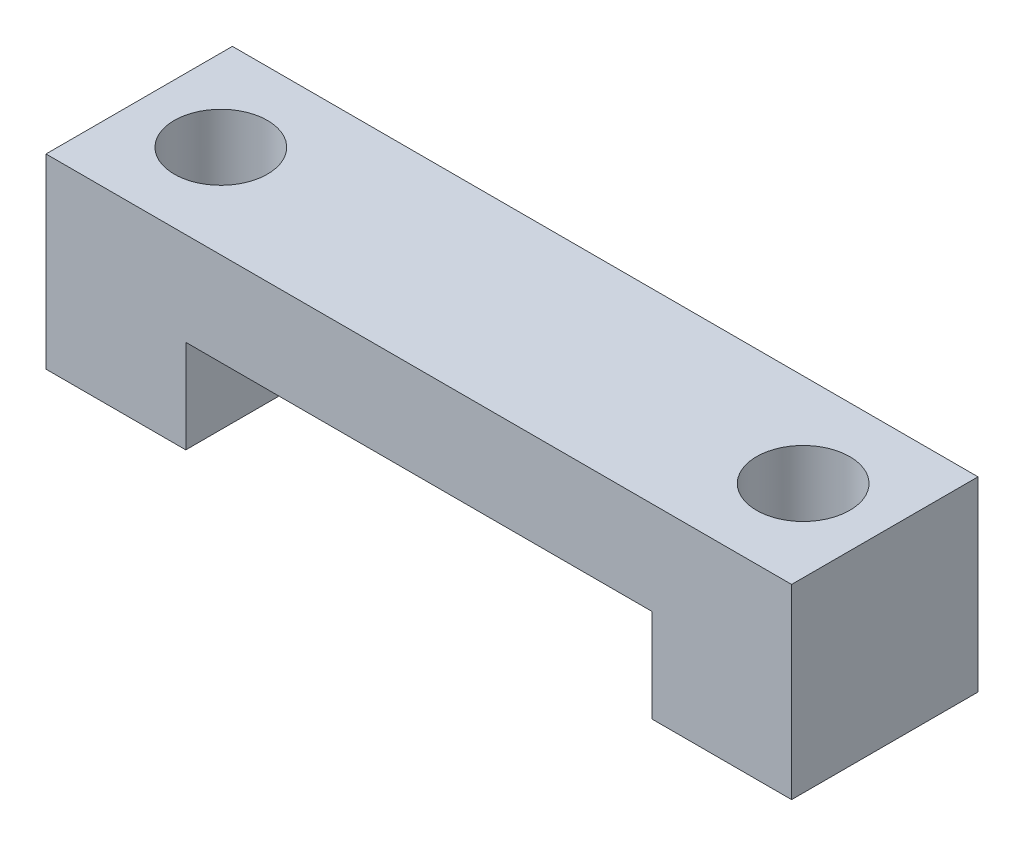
SolidWorks part; units mm, degrees
ref_plane "Front Plane" through (0, 0, 0) normal (0, 0, 1) x (1, 0, 0)
ref_plane "Top Plane" through (0, 0, 0) normal (0, 1, 0) x (1, 0, 0)
ref_plane "Right Plane" through (0, 0, 0) normal (1, 0, 0) x (0, 0, -1)
sketch "Sketch1" plane through (0, 0, 0) normal (0, 0, 1) x (1, 0, 0)
  line L0 (0, 0) -> (0, 9.6145) construction
  line L1 (15.875, 0) -> (15.875, 6.35)
  line L2 (15.875, 6.35) -> (-15.875, 6.35)
  line L3 (-15.875, 6.35) -> (-15.875, 0)
  line L4 (-15.875, 0) -> (-25.4, 0)
  line L5 (-25.4, 0) -> (-25.4, 12.7)
  line L6 (-25.4, 12.7) -> (25.4, 12.7)
  line L7 (25.4, 12.7) -> (25.4, 0)
  line L8 (25.4, 0) -> (15.875, 0)
  line L9 (-19.8374, 0) -> (-19.8374, 12.7)
  line L10 (19.8374, 0) -> (19.8374, 12.7)
  dimension "D1" = 31.75
  dimension "D2" = 50.8
  dimension "D3" = 6.35
  dimension "D4" = 6.35
  dimension "D5" = 5.5626
  dimension "D6" = 3.9624
  dimension "D7" = 12.7
sketch "Sketch2" plane through (0, 0, 0) normal (0, 0, 1) x (1, 0, 0)
  line L0 (-15.875, 0) -> (-25.4, 0) construction
  line L1 (-25.4, 0) -> (-25.4, 12.7) construction
  line L2 (-25.4, 12.7) -> (25.4, 12.7) construction
  line L3 (25.4, 12.7) -> (25.4, 0) construction
  line L4 (25.4, 0) -> (15.875, 0) construction
  line L8 (-15.875, 0) -> (-25.4, 0)
  line L9 (-25.4, 0) -> (-25.4, 12.7)
  line L10 (-25.4, 12.7) -> (25.4, 12.7)
  line L11 (25.4, 12.7) -> (25.4, 0)
  line L12 (25.4, 0) -> (15.875, 0)
  line L13 (-15.875, 6.35) -> (-15.875, 0) construction
  line L16 (15.875, 6.35) -> (-15.875, 6.35) construction
  line L19 (15.875, 0) -> (15.875, 6.35) construction
  line L20 (-15.875, 6.35) -> (-15.875, 0)
  line L23 (15.875, 6.35) -> (-15.875, 6.35)
  line L26 (15.875, 0) -> (15.875, 6.35)
extrude "Boss-Extrude1" add sketch "Sketch2" along normal mid plane 12.7
sketch "Sketch3" plane through (0, 0, 0) normal (0, 1, 0) x (1, 0, 0)
  circle A0 centre (-19.8374, 0) radius 3.175
  circle A1 centre (19.8374, 0) radius 3.175
  dimension "D1" = 6.35
extrude "Cut-Extrude1" cut sketch "Sketch3" along normal blind 25.4
